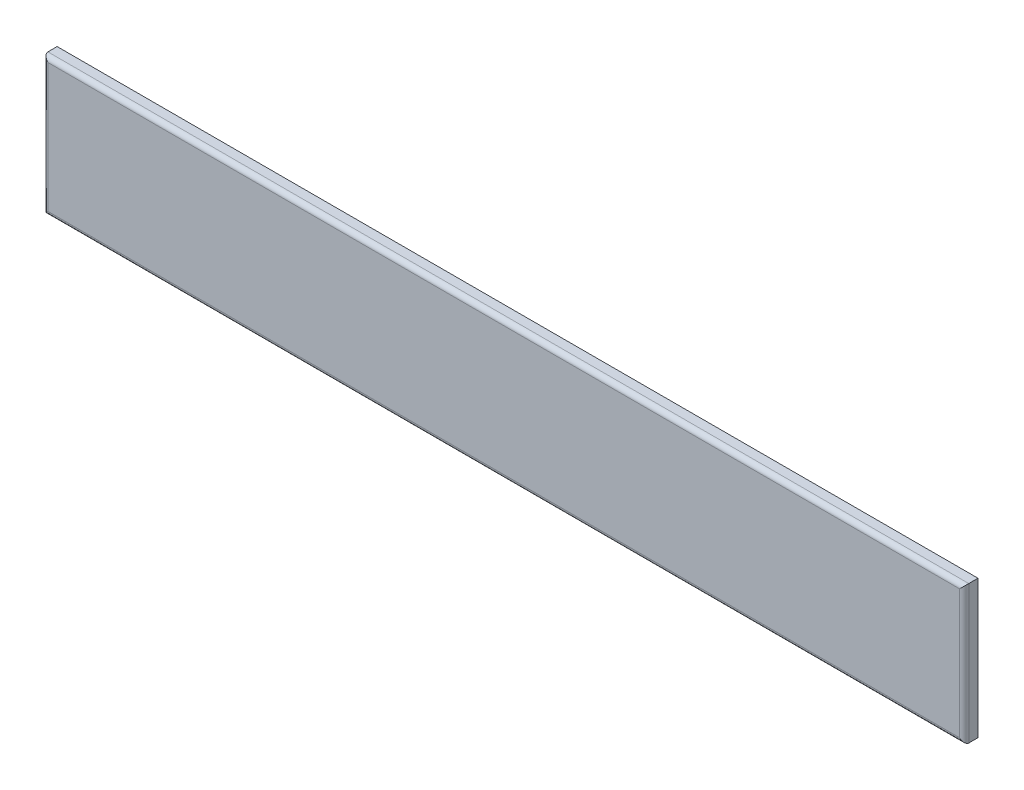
SolidWorks part; units mm, degrees
ref_plane "Спереди" through (0, 0, 0) normal (0, 0, 1) x (1, 0, 0)
ref_plane "Сверху" through (0, 0, 0) normal (0, 1, 0) x (1, 0, 0)
ref_plane "Справа" through (0, 0, 0) normal (1, 0, 0) x (0, 0, -1)
sketch "Эскиз1" plane through (0, 0, 0) normal (0, 0, 1) x (1, 0, 0)
  line L1 (0, 0) -> (-2000, 0)
  line L2 (0, 0) -> (0, -300)
  line L3 (0, -300) -> (-2000, -300)
  line L4 (-2000, 0) -> (-2000, -300)
  dimension "D1" = 2000
  dimension "D2" = 300
extrude "Бобышка-Вытянуть1" add sketch "Эскиз1" along normal blind 30
fillet "Скругление1" radius 10 4 edges at (-1000, -300, 30) (-2000, -150, 30) (-1000, 0, 30) (0, -150, 30)
